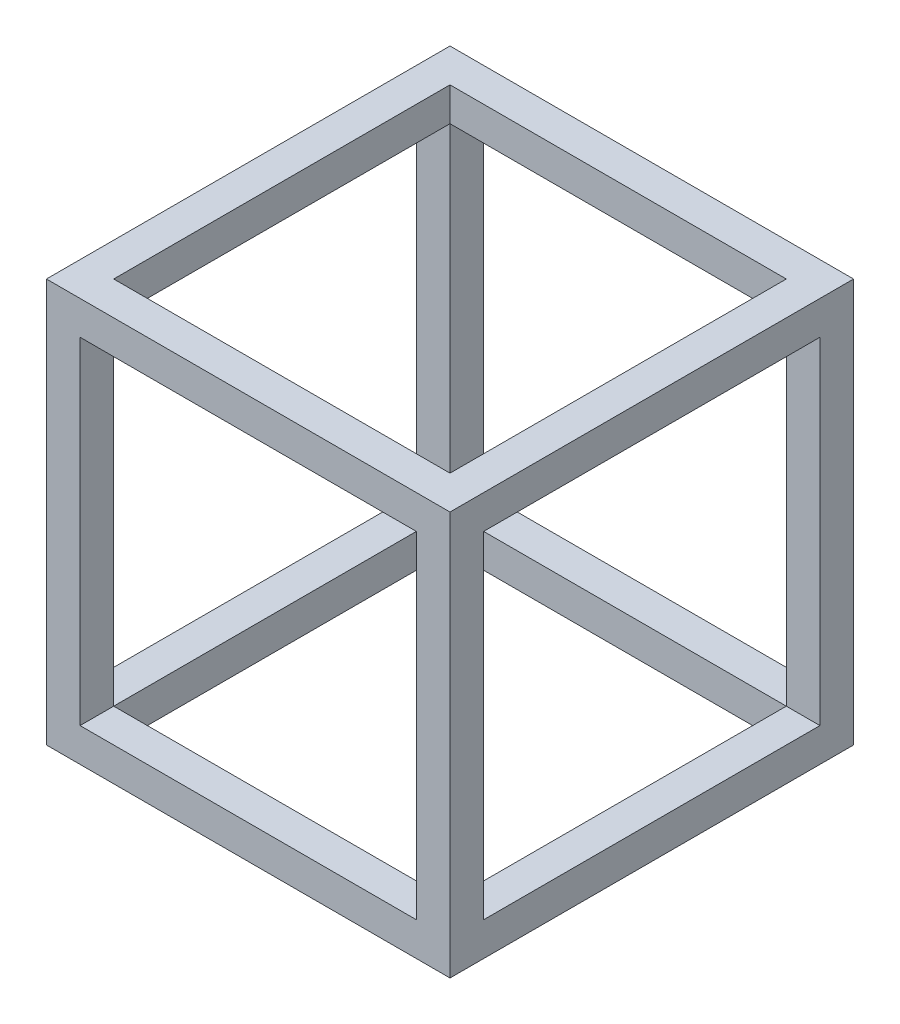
SolidWorks part; units mm, degrees
ref_plane "Front" through (0, 0, 0) normal (0, 0, 1) x (1, 0, 0)
ref_plane "Top" through (0, 0, 0) normal (0, 1, 0) x (1, 0, 0)
ref_plane "Side" through (0, 0, 0) normal (1, 0, 0) x (0, 0, -1)
sketch "Sketch1" plane through (0, 0, 0) normal (0, 0, 1) x (1, 0, 0)
  line L0 (-38.1, -38.1) -> (38.1, 38.1) construction
  line L1 (-38.1, -38.1) -> (38.1, -38.1)
  line L2 (-38.1, -38.1) -> (-38.1, 38.1)
  line L3 (-38.1, 38.1) -> (38.1, 38.1)
  line L4 (38.1, -38.1) -> (38.1, 38.1)
  dimension "D1" = 76.2
  dimension "D2" = 76.2
extrude "Extrude1" add sketch "Sketch1" along normal mid plane 76.2
sketch "Sketch2" plane through (0, 38.1, 0) normal (0, 1, 0) x (-1, 0, 0)
  line L4 (-31.75, -31.75) -> (31.75, -31.75)
  line L5 (31.75, -31.75) -> (31.75, 31.75)
  line L6 (31.75, 31.75) -> (-31.75, 31.75)
  line L7 (-31.75, 31.75) -> (-31.75, -31.75)
  line L8 (-31.75, -31.75) -> (31.75, -31.75)
  line L9 (31.75, -31.75) -> (31.75, 31.75)
  line L10 (31.75, 31.75) -> (-31.75, 31.75)
  line L11 (-31.75, 31.75) -> (-31.75, -31.75)
  dimension "D1" = 6.35
extrude "Cut-Extrude1" cut sketch "Sketch2" against normal through all
sketch "Sketch3" plane through (38.1, 0, 0) normal (1, 0, 0) x (0, 0, -1)
  line L4 (31.75, -31.75) -> (31.75, 31.75)
  line L5 (31.75, 31.75) -> (-31.75, 31.75)
  line L6 (-31.75, 31.75) -> (-31.75, -31.75)
  line L7 (-31.75, -31.75) -> (31.75, -31.75)
  line L8 (31.75, -31.75) -> (31.75, 31.75)
  line L9 (31.75, 31.75) -> (-31.75, 31.75)
  line L10 (-31.75, 31.75) -> (-31.75, -31.75)
  line L11 (-31.75, -31.75) -> (31.75, -31.75)
  dimension "D1" = 6.35
extrude "Cut-Extrude2" cut sketch "Sketch3" against normal through all
sketch "Sketch4" plane through (0, 0, 38.1) normal (0, 0, 1) x (1, 0, 0)
  line L4 (-31.75, 31.75) -> (-31.75, -31.75)
  line L5 (-31.75, -31.75) -> (31.75, -31.75)
  line L6 (31.75, -31.75) -> (31.75, 31.75)
  line L7 (31.75, 31.75) -> (-31.75, 31.75)
  line L8 (-31.75, 31.75) -> (-31.75, -31.75)
  line L9 (-31.75, -31.75) -> (31.75, -31.75)
  line L10 (31.75, -31.75) -> (31.75, 31.75)
  line L11 (31.75, 31.75) -> (-31.75, 31.75)
  dimension "D1" = 6.35
extrude "Cut-Extrude3" cut sketch "Sketch4" against normal through all
